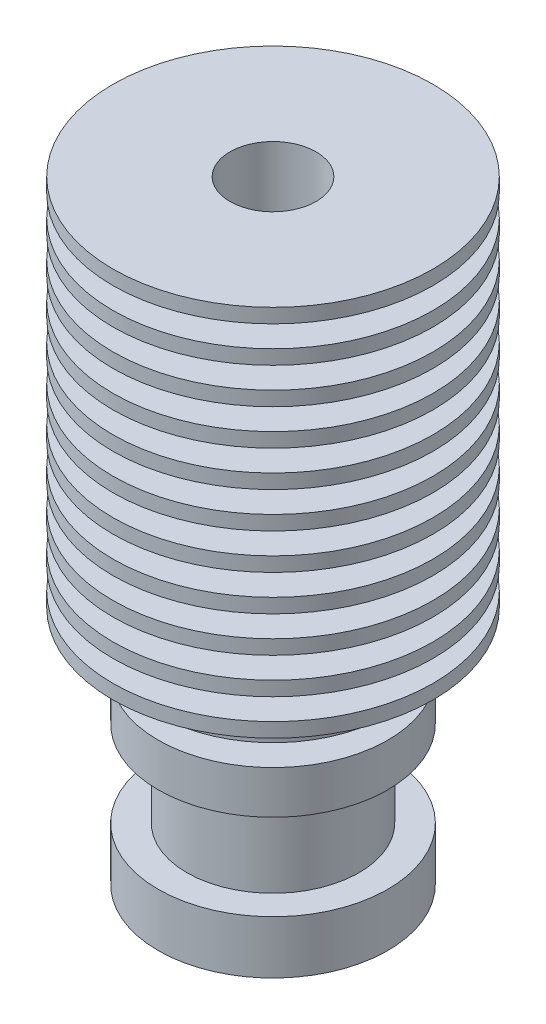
SolidWorks part; units mm, degrees
ref_plane "Plan de face" through (0, 0, 0) normal (0, 0, 1) x (1, 0, 0)
ref_plane "Plan de dessus" through (0, 0, 0) normal (0, 1, 0) x (1, 0, 0)
ref_plane "Plan de droite" through (0, 0, 0) normal (1, 0, 0) x (0, 0, -1)
ref_plane "Plan1" through (0, 14.2, 0) normal (0, 1, 0) x (1, 0, 0)
ref_plane "Plan2" through (0, 16.7, 0) normal (0, 1, 0) x (1, 0, 0)
sketch "Esquisse1" plane through (0, 0, 0) normal (0, 1, 0) x (1, 0, 0)
  circle A1 centre (0, 0) radius 8
  dimension "D2" = 16
extrude "Boss.-Extru.1" add sketch "Esquisse1" along normal blind 3.7
sketch "Esquisse2" plane through (0, 3.7, 0) normal (0, 1, 0) x (1, 0, 0)
  circle A1 centre (0, 0) radius 6
  dimension "D2" = 12
extrude "Boss.-Extru.2" add sketch "Esquisse2" along normal blind 6
sketch "Esquisse3" plane through (0, 9.7, 0) normal (0, 1, 0) x (1, 0, 0)
  circle A0 centre (0, 0) radius 2.1
  circle A1 centre (0, 0) radius 8
  point P2 (0, 0)
  dimension "D1" = 4.2
  dimension "D2" = 16
extrude "Boss.-Extru.3" add sketch "Esquisse3" along normal blind 3
sketch "Esquisse4" plane through (0, 12.7, 0) normal (0, 1, 0) x (1, 0, 0)
  circle A1 centre (0, 0) radius 4.5
  dimension "D2" = 9
extrude "Boss.-Extru.4" add sketch "Esquisse4" along normal blind 30 draft 3
sketch "Esquisse5" plane through (0, 42.7, 0) normal (0, 1, 0) x (1, 0, 0)
  circle A0 centre (0, 0) radius 2.1
  dimension "D1" = 4.2
extrude "Enlèv. mat.-Extru.1" cut sketch "Esquisse5" against normal up to next
hole_wizard "Отверстие обработанное метчиком M7x1.01" positions "Esquisse8" profile "Esquisse7" tap size "M7x1.0" standard "DIN"
sketch "Esquisse8" plane through (0, 42.7, 0) normal (0, 1, 0) x (1, 0, 0)
  point P0 (0, 0)
sketch "Esquisse7" plane through (0, 42.7, 0) normal (1, 0, 0) x (0, 0, 1)
  line L0 (0, 0) -> (0, 16.6026)
  line L1 (0, 16.6026) -> (3, 14.8)
  line L2 (3, 14.8) -> (3, 0)
  line L5 (3, 0) -> (0, 0)
  line L10 (0, 16.6026) -> (-3, 14.8) construction
  line L11 (0, -6.35) -> (0, 107.95) construction
  dimension "Diamètre du trou pour taraudage" = 6
  dimension "Profondeur du trou pour taraudage" = 14.8
  dimension "Angle de pointe" = 118
sketch "Esquisse9" plane through (0, 14.2, 0) normal (0, 1, 0) x (1, 0, 0)
  circle A0 centre (0, 0) radius 8
  circle A1 centre (0, 0) radius 4.25
  dimension "D1" = 16
  dimension "D2" = 8.5
extrude "Boss.-Extru.5" add sketch "Esquisse9" along normal blind 1
sketch "Esquisse10" plane through (0, 16.7, 0) normal (0, 1, 0) x (1, 0, 0)
  circle A0 centre (0, 0) radius 4.25
  circle A1 centre (0, 0) radius 11.15
  dimension "D1" = 8.5
  dimension "D2" = 22.3
extrude "Boss.-Extru.6" add sketch "Esquisse10" along normal blind 1
sketch "Esquisse11" plane through (0, 0, 0) normal (0, 0, 1) x (1, 0, 0)
  line L0 (0, 44.0354) -> (0, -2.7213) construction
pattern_linear "Répétition linéaire1" count 11 spacing 2.5 along (0, 1, 0) of "Boss.-Extru.6"
hole_wizard "Trou taraudé M51" positions "Esquisse13" profile "Esquisse12" tap size "M5" standard "Iso"
sketch "Esquisse13" plane through (0, 0, 0) normal (0, -1, 0) x (-1, 0, 0)
  point P0 (0, 0)
sketch "Esquisse12" plane through (0, 0, 0) normal (1, 0, 0) x (0, 0, -1)
  line L0 (0, 0) -> (0, 13.6618)
  line L1 (0, 13.6618) -> (2.1, 12.4)
  line L2 (2.1, 12.4) -> (2.1, 0)
  line L5 (2.1, 0) -> (0, 0)
  line L10 (0, 13.6618) -> (-2.1, 12.4) construction
  line L11 (0, -6.35) -> (0, 107.95) construction
  dimension "Diamètre du trou pour taraudage" = 4.2
  dimension "Profondeur du trou pour taraudage" = 12.4
  dimension "Angle de pointe" = 118
